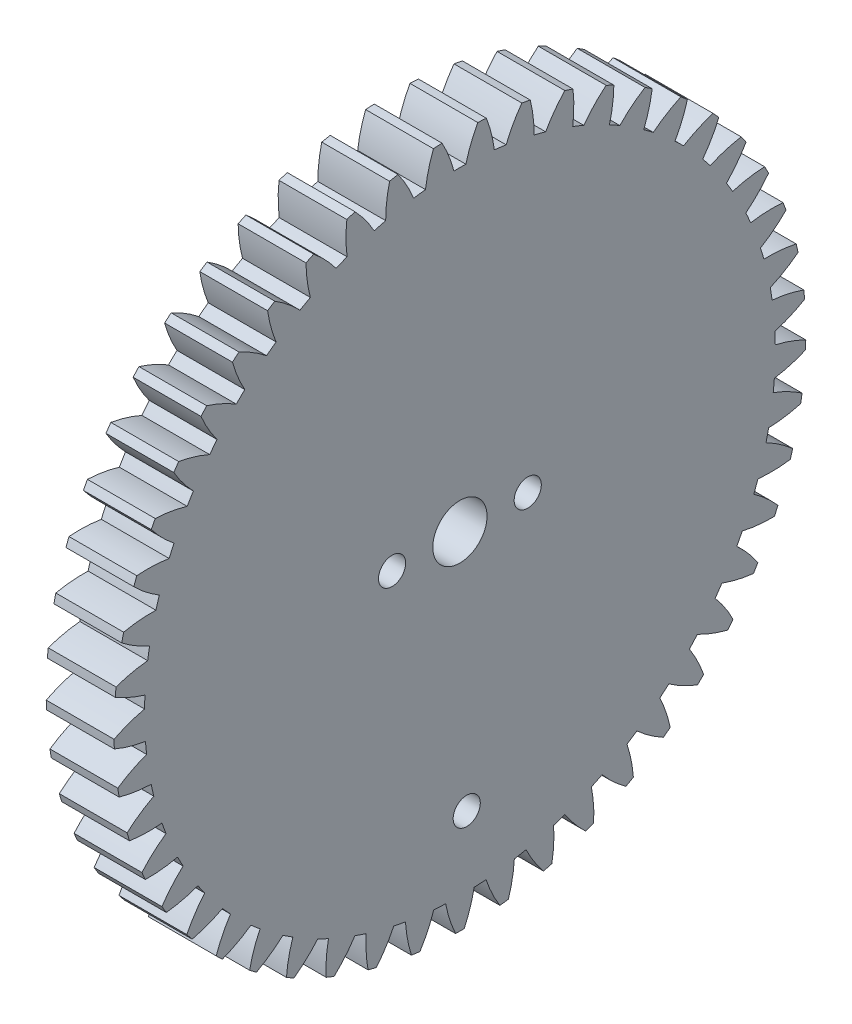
SolidWorks part; units mm, degrees
ref_plane "Front Plane" through (0, 0, 0) normal (0, 0, 1) x (1, 0, 0)
ref_plane "Top Plane" through (0, 0, 0) normal (0, 1, 0) x (1, 0, 0)
ref_plane "Right Plane" through (0, 0, 0) normal (1, 0, 0) x (0, 0, -1)
inserted part "spur gear_am<3>@tmpAssm"
sketch "Sketch1" plane through (-5.7393, 0, 0) normal (1, 0, 0) x (0, 0, -1)
  line L0 (56.4884, -29.4442) -> (77.7561, -29.4442) construction
  line L1 (56.4884, -29.4442) -> (57.0591, -49.9491) construction
  line L2 (56.4884, -29.4442) -> (42.7826, -29.4442) construction
  circle A0 centre (56.9914, -47.5169) radius 1
  circle A1 centre (56.4884, -29.4442) radius 2 construction
  circle A2 centre (51.4884, -29.4442) radius 1
  circle A3 centre (61.4884, -29.4442) radius 1
  dimension "D2" = 18.0797
  dimension "D3" = 5
  dimension "D4" = 5
  dimension "D1" = 271.594
extrude "Cut-Extrude1" cut sketch "Sketch1" against normal blind 5
sketch "Sketch2" plane through (-5.7393, 0, 0) normal (1, 0, 0) x (0, 0, -1)
  line L0 (52.4884, -29.4442) -> (60.4884, -29.4442)
  circle A0 centre (51.4884, -29.4442) radius 1 construction
  circle A1 centre (61.4884, -29.4442) radius 1 construction
